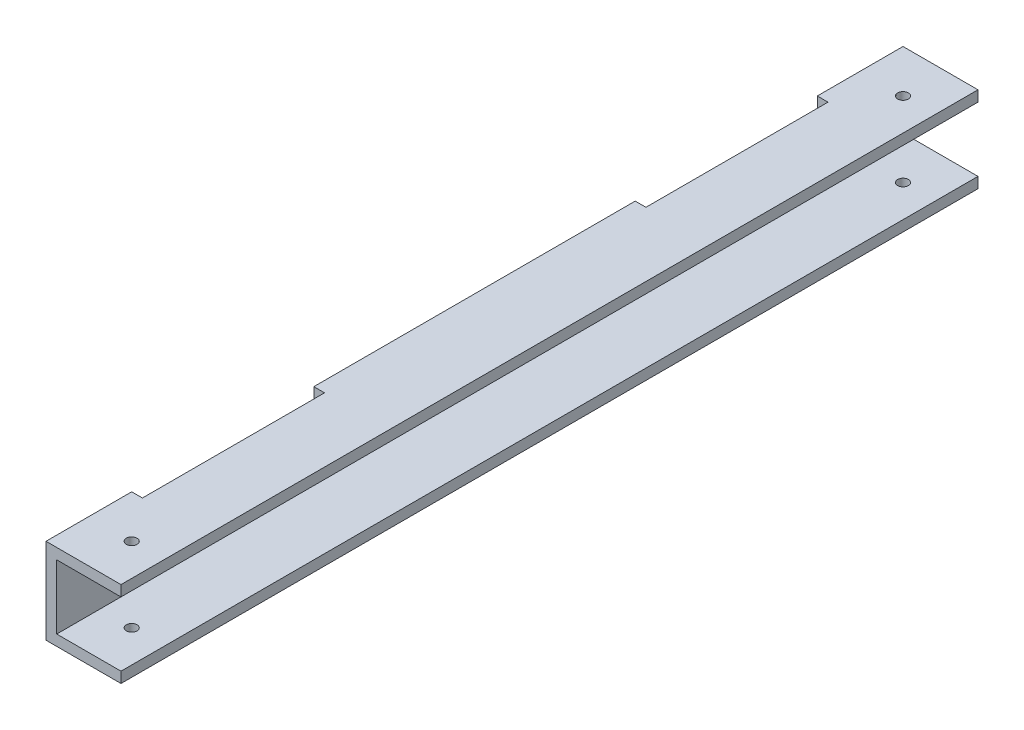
SolidWorks part; units mm, degrees
ref_plane "Front" through (0, 0, 0) normal (0, 0, 1) x (1, 0, 0)
ref_plane "Top" through (0, 0, 0) normal (0, 1, 0) x (1, 0, 0)
ref_plane "Right" through (0, 0, 0) normal (1, 0, 0) x (0, 0, -1)
sketch "스케치1" plane through (0, 0, 0) normal (0, 0, 1) x (1, 0, 0)
  line L0 (11.1125, 9.525) -> (11.1125, 12.7)
  line L1 (11.1125, -12.7) -> (-11.1125, -12.7)
  line L2 (11.1125, -12.7) -> (11.1125, -9.525)
  line L3 (11.1125, 12.7) -> (-11.1125, 12.7)
  line L4 (-11.1125, -12.7) -> (-11.1125, 12.7)
  line L7 (-7.9375, 9.525) -> (11.1125, 9.525)
  line L8 (-7.9375, 9.525) -> (-7.9375, -9.525)
  line L9 (-7.9375, -9.525) -> (11.1125, -9.525)
  point P0 (0, 0)
  dimension "D1" = 25.4
  dimension "D2" = 22.225
  dimension "D3" = 3.175
  dimension "D4" = 3.175
  dimension "D5" = 3.175
extrude "보스-돌출1" add sketch "스케치1" along normal blind 254
sketch "스케치2" plane through (0, 12.7, 0) normal (0, 1, 0) x (1, 0, 0)
  line L0 (11.1125, -254) -> (-11.1125, -254) construction
  line L1 (-11.1125, -254) -> (-11.1125, 0) construction
  line L2 (11.1125, 0) -> (-11.1125, 0) construction
  line L4 (-7.9375, -25.4) -> (-11.1125, -25.4)
  line L5 (-7.9375, -25.4) -> (-7.9375, -79.375)
  line L6 (-7.9375, -79.375) -> (-11.1125, -79.375)
  line L7 (-11.1125, -25.4) -> (-11.1125, -79.375)
  line L8 (-11.1125, -228.6) -> (-7.9375, -228.6)
  line L9 (-11.1125, -228.6) -> (-11.1125, -174.625)
  line L10 (-11.1125, -174.625) -> (-7.9375, -174.625)
  line L11 (-7.9375, -228.6) -> (-7.9375, -174.625)
  circle A0 centre (1.5875, -241.3) radius 1.5875
  circle A1 centre (1.5875, -12.7) radius 1.5875
  dimension "D1" = 12.7
  dimension "D3" = 3.175
  dimension "D4" = 12.7
  dimension "D6" = 3.175
  dimension "D2" = 12.7
  dimension "D5" = 12.7
  dimension "D7" = 3.175
  dimension "D8" = 3.175
  dimension "D9" = 53.975
  dimension "D10" = 53.975
  dimension "D11" = 25.4
  dimension "D12" = 25.4
extrude "컷-돌출1" cut sketch "스케치2" against normal blind 25.4
sketch "스케치3" plane through (-11.1125, 0, 0) normal (-1, 0, 0) x (0, 0, 1)
  line L0 (254, -12.7) -> (228.6, -12.7) construction
  line L2 (0, 12.7) -> (0, -12.7) construction
  line L3 (79.375, -12.7) -> (79.375, 12.7) construction
  line L4 (174.625, -12.7) -> (79.375, -12.7) construction
  line L5 (127, -12.7) -> (127, 12.7) construction
  line L6 (174.625, 12.7) -> (79.375, 12.7) construction
  circle A0 centre (12.7, 0) radius 1.5875
  circle A1 centre (92.075, 0) radius 1.5875
  circle A2 centre (241.3, 0) radius 1.5875
  circle A3 centre (161.925, 0) radius 1.5875
  dimension "D1" = 12.7
  dimension "D3" = 3.175
  dimension "D4" = 12.7
  dimension "D6" = 3.175
  dimension "D2" = 12.7
  dimension "D5" = 12.7
extrude "컷-돌출2" cut sketch "스케치3" against normal blind 5.08
